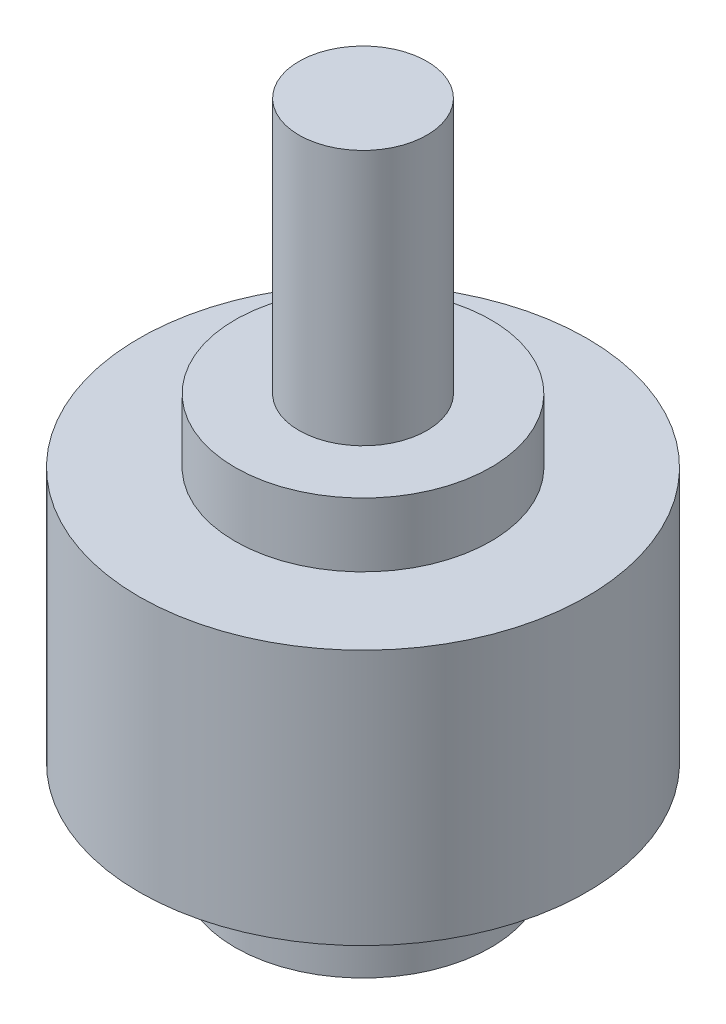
SolidWorks part; units mm, degrees
ref_plane "front" through (0, 0, 0) normal (0, 0, 1) x (1, 0, 0)
ref_plane "top" through (0, 0, 0) normal (0, 1, 0) x (1, 0, 0)
ref_plane "side" through (0, 0, 0) normal (1, 0, 0) x (0, 0, -1)
sketch "Sketch1" plane through (0, 0, 0) normal (0, 0, 1) x (1, 0, 0)
  line L0 (0, 0) -> (0, -28.7465) construction
  line L1 (0, 0) -> (25.4, 0)
  line L2 (25.4, 0) -> (25.4, 19.05)
  line L3 (25.4, 19.05) -> (44.45, 19.05)
  line L4 (44.45, 19.05) -> (44.45, 69.85)
  line L5 (44.45, 69.85) -> (25.4, 69.85)
  line L6 (25.4, 69.85) -> (25.4, 82.55)
  line L7 (25.4, 82.55) -> (12.7, 82.55)
  line L8 (12.7, 82.55) -> (12.7, 133.35)
  line L9 (12.7, 133.35) -> (0, 133.35)
  line L10 (0, 133.35) -> (0, 0)
  dimension "D1" = 50.8
  dimension "D2" = 19.05
  dimension "D3" = 50.8
  dimension "D4" = 12.7
  dimension "D5" = 25.4
  dimension "D6" = 50.8
  dimension "D7" = 88.9
revolve "Base-Revolve" add sketch "Sketch1" angle 360 about L0
sketch "Sketch2" plane through (0, 0, 0) normal (0, -1, 0) x (1, 0, 0)
  circle A0 centre (0, 0) radius 12.7
  dimension "D1" = 25.4
extrude "Cut-Extrude1" cut sketch "Sketch2" against normal blind 50.8
